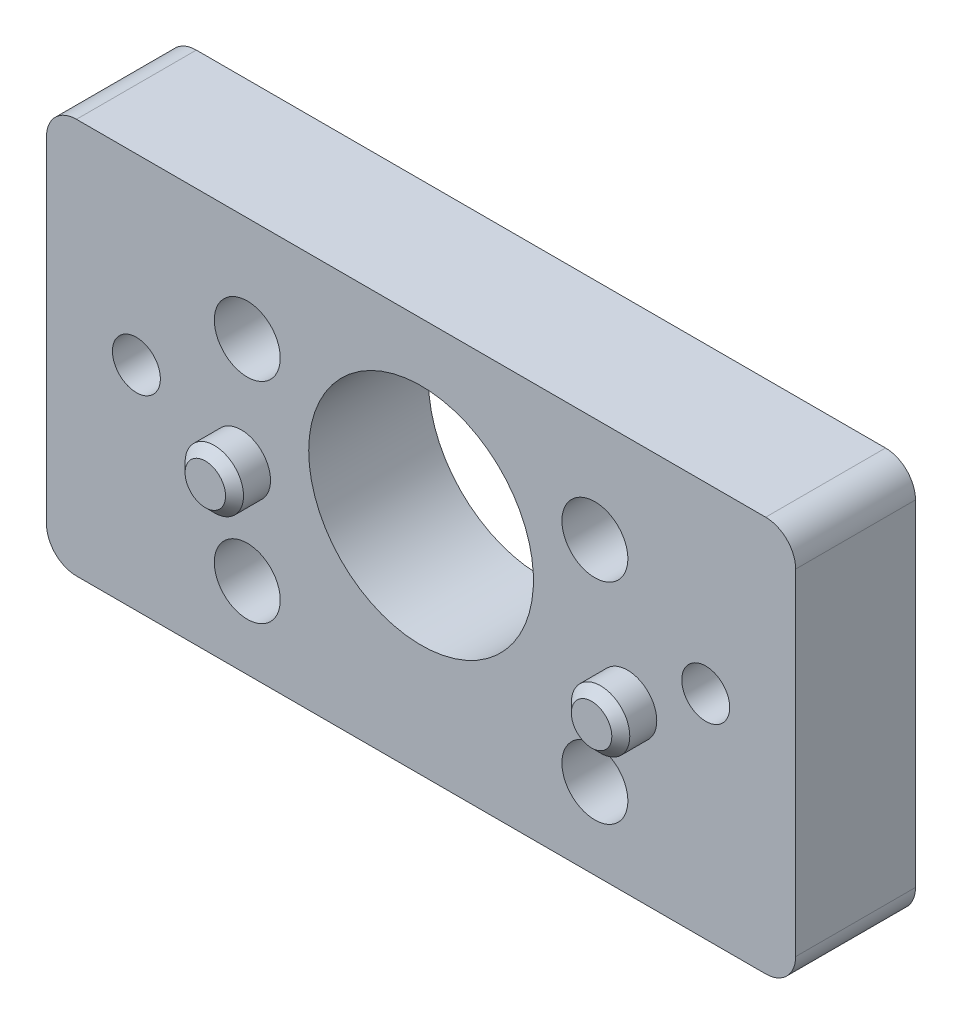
SolidWorks part; units mm, degrees
ref_plane "前视基准面" through (0, 0, 0) normal (0, 0, 1) x (1, 0, 0)
ref_plane "上视基准面" through (0, 0, 0) normal (0, 1, 0) x (1, 0, 0)
ref_plane "右视基准面" through (0, 0, 0) normal (1, 0, 0) x (0, 0, -1)
sketch "草图1" plane through (0, 0, 0) normal (0, 0, 1) x (1, 0, 0)
  line L1 (-12.5, 6.1) -> (12.5, 6.1)
  line L2 (-12.5, 6.1) -> (-12.5, -6.1)
  line L3 (-12.5, -6.1) -> (12.5, -6.1)
  line L4 (12.5, 6.1) -> (12.5, -6.1)
  line L5 (-12.5, 6.1) -> (12.5, -6.1) construction
  line L6 (-12.5, -6.1) -> (12.5, 6.1) construction
  point P0 (0, 0)
  dimension "D1" = 25
  dimension "D2" = 12.2
extrude "凸台-拉伸1" add sketch "草图1" along normal blind 4
hole_wizard "打孔尺寸(%根据)内六角圆柱头螺钉的类型1" positions "草图2" profile "草图3" counterbore size "M2" standard "GB"
sketch "草图2" plane through (0, 0, 0) normal (0, 0, -1) x (-1, 0, 0)
  point P0 (-5.8, 3.6)
  point P3 (5.8, 3.6)
  point P6 (-5.8, -3.4)
  point P9 (5.8, -3.4)
sketch "草图3" plane through (5.8, 3.6, 0) normal (1, 0, 0) x (0, 1, 0)
  line L0 (0, 0) -> (0, 4)
  line L1 (0, 4) -> (1.1, 4)
  line L3 (1.1, 4) -> (1.1, 2.2)
  line L4 (1.1, 2.2) -> (2.1, 2.2)
  line L5 (2.1, 2.2) -> (2.1, 0)
  line L7 (2.1, 0) -> (0, 0)
  line L11 (0, -6.35) -> (0, 107.95) construction
  dimension "通孔孔直径" = 2.2
  dimension "通孔孔深度" = 4
  dimension "柱形沉头孔直径" = 4.2
  dimension "柱形沉头孔深度" = 2.2
sketch "草图4" plane through (0, 0, 0) normal (0, 0, -1) x (-1, 0, 0)
  circle A0 centre (0, 1.4) radius 3.75
  dimension "D1" = 7.5
extrude "切除-拉伸1" cut sketch "草图4" against normal through all
sketch "草图5" plane through (0, 0, 4) normal (0, 0, 1) x (1, 0, 0)
  line L1 (-12.5, -6.1) -> (12.5, -6.1) construction
  circle A0 centre (-6, -0.1) radius 0.975
  circle A1 centre (6.8903, -0.6) radius 0.975
  dimension "D1" = 1.95
  dimension "D2" = 1.95
  dimension "D3" = 12.9
  dimension "D4" = 5.5
extrude "凸台-拉伸2" add sketch "草图5" along normal blind 1.2
chamfer "倒角1" distance 0.3 angle 45 2 edges at (-5.025, -0.1, 5.2) (7.8653, -0.6, 5.2)
sketch "草图6" plane through (0, 0, 0) normal (0, 0, -1) x (-1, 0, 0)
  line L0 (9.5, -3.6) -> (10.5, -3.6) construction
  line L1 (9.5, -2.575) -> (10.5, -2.575)
  line L2 (9.5, -4.625) -> (10.5, -4.625)
  circle A0 centre (-10, -3.6) radius 1.025
  circle A1 centre (10, -3.6) radius 0.975 construction
  circle A2 centre (10, -3.6) radius 0.975 construction
  arc A3 (9.5, -2.575) -> (9.5, -4.625) centre (9.5, -3.6) ccw
  arc A4 (10.5, -4.625) -> (10.5, -2.575) centre (10.5, -3.6) ccw
  point P8 (10, -3.6)
  dimension "D1" = 2.05
  dimension "D2" = 0.5
  dimension "D3" = 0.5
  dimension "D4" = 1.025
extrude "切除-拉伸2" cut sketch "草图6" against normal blind 2
chamfer "倒角2" distance 0.3 angle 45 5 edges at (8.975, -3.6, 0) (-8.475, -3.6, 0) (-10, -4.625, 0) (-10, -2.575, 0) (-11.525, -3.6, 0)
hole_wizard "M2 螺纹孔1" positions "草图7" profile "草图8" tap size "M2" standard "GB"
sketch "草图7" plane through (0, 0, 0) normal (0, 0, -1) x (-1, 0, 0)
  point P0 (-9.5, 1)
  point P3 (9.5, 1)
sketch "草图8" plane through (9.5, 1, 0) normal (1, 0, 0) x (0, 1, 0)
  line L0 (0, 0) -> (0, 5.2)
  line L1 (0, 5.2) -> (0.8, 5.2)
  line L2 (0.8, 5.2) -> (0.8, 0)
  line L5 (0.8, 0) -> (0, 0)
  line L11 (0, -6.35) -> (0, 107.95) construction
  dimension "通孔螺纹孔钻头直径" = 1.6
  dimension "通孔螺纹孔钻头深度" = 5.2
sketch "草图9" plane through (0, 6.1, 0) normal (0, 1, 0) x (1, 0, 0)
  line L4 (12.5, 0) -> (-12.5, 0)
  line L5 (-12.5, 0) -> (-12.5, -4)
  line L6 (-12.5, -4) -> (12.5, -4)
  line L7 (12.5, -4) -> (12.5, 0)
  line L8 (12.5, 0) -> (-12.5, 0)
  line L9 (-12.5, 0) -> (-12.5, -4)
  line L10 (-12.5, -4) -> (12.5, -4)
  line L11 (12.5, -4) -> (12.5, 0)
  dimension "D1" = 0
extrude "凸台-拉伸3" add sketch "草图9" along normal blind 1
fillet "圆角1" radius 1 4 edges at (-12.5, -6.1, 2) (12.5, -6.1, 2) (-12.5, 7.1, 2) (12.5, 7.1, 2)
